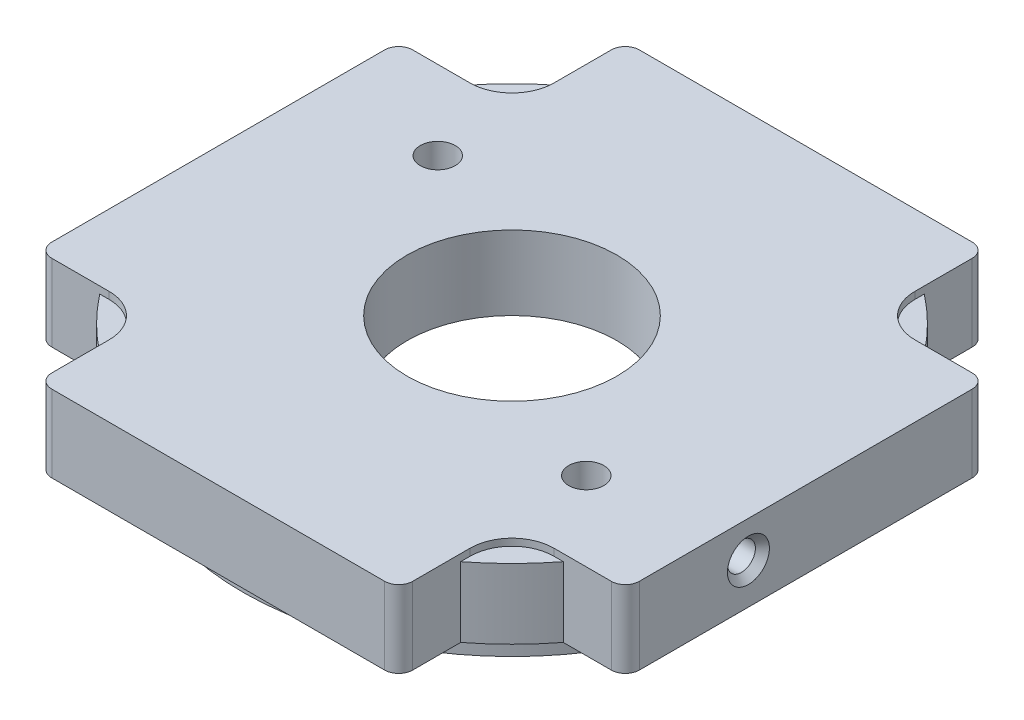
SolidWorks part; units mm, degrees
ref_plane "Front Plane" through (0, 0, 0) normal (0, 0, 1) x (1, 0, 0)
ref_plane "Top Plane" through (0, 0, 0) normal (0, 1, 0) x (1, 0, 0)
ref_plane "Right Plane" through (0, 0, 0) normal (1, 0, 0) x (0, 0, -1)
ref_plane "Plane1" through (0, 2, 0) normal (0, -1, 0) x (1, 0, 0)
sketch "Sketch1" plane through (0, 2, 0) normal (0, -1, 0) x (1, 0, 0)
  line L0 (-21, 21) -> (-21, -21)
  line L1 (-21, -21) -> (21, -21)
  line L2 (21, -21) -> (21, 21)
  line L3 (21, 21) -> (-21, 21)
extrude "Boss-Extrude1" add sketch "Sketch1" against normal blind 5.5
sketch "Sketch2" plane through (0, 2, 0) normal (0, -1, 0) x (1, 0, 0)
  line L0 (-12.9, -21) -> (-12.9, -16.5708)
  line L1 (-16.5708, -12.9) -> (-21, -12.9)
  line L2 (-21, -12.9) -> (-21, -21)
  line L3 (-21, -21) -> (-12.9, -21)
  arc A0 (-12.9, -16.5708) -> (-16.5708, -12.9) centre (0, 0) cw
extrude "Cut-Extrude1" cut sketch "Sketch2" against normal through all
ref_plane "Plane2" through (0, 7.5, 0) normal (0, 1, 0) x (-1, 0, 0)
ref_plane "Plane3" through (0, 7, 0) normal (0, -1, 0) x (1, 0, 0)
sketch "Sketch4" plane through (0, 7, 0) normal (0, -1, 0) x (1, 0, 0)
  line L0 (-12.9, -12.9) -> (-16.5708, -12.9)
  line L1 (-12.9, -16.5708) -> (-12.9, -12.9)
  arc A0 (-16.5708, -12.9) -> (-12.9, -16.5708) centre (0, 0) ccw
extrude "Cut-Extrude2" cut sketch "Sketch4" against normal up to surface
sketch "Sketch5" plane through (0, 2, 0) normal (0, -1, 0) x (1, 0, 0)
  line L0 (-21, 12.9) -> (-16.5708, 12.9)
  line L1 (-12.9, 16.5708) -> (-12.9, 21)
  line L2 (-12.9, 21) -> (-21, 21)
  line L3 (-21, 21) -> (-21, 12.9)
  arc A0 (-16.5708, 12.9) -> (-12.9, 16.5708) centre (0, 0) cw
extrude "Cut-Extrude3" cut sketch "Sketch5" against normal through all
sketch "Sketch7" plane through (0, 7, 0) normal (0, -1, 0) x (1, 0, 0)
  line L0 (-12.9, 12.9) -> (-12.9, 16.5708)
  line L1 (-16.5708, 12.9) -> (-12.9, 12.9)
  arc A0 (-12.9, 16.5708) -> (-16.5708, 12.9) centre (0, 0) ccw
extrude "Cut-Extrude4" cut sketch "Sketch7" against normal up to surface
sketch "Sketch8" plane through (0, 2, 0) normal (0, -1, 0) x (1, 0, 0)
  line L0 (12.9, 21) -> (12.9, 16.5708)
  line L1 (16.5708, 12.9) -> (21, 12.9)
  line L2 (21, 12.9) -> (21, 21)
  line L3 (21, 21) -> (12.9, 21)
  arc A0 (12.9, 16.5708) -> (16.5708, 12.9) centre (0, 0) cw
extrude "Cut-Extrude5" cut sketch "Sketch8" against normal through all
sketch "Sketch10" plane through (0, 7, 0) normal (0, -1, 0) x (1, 0, 0)
  line L0 (12.9, 12.9) -> (16.5708, 12.9)
  line L1 (12.9, 16.5708) -> (12.9, 12.9)
  arc A0 (16.5708, 12.9) -> (12.9, 16.5708) centre (0, 0) ccw
extrude "Cut-Extrude6" cut sketch "Sketch10" against normal up to surface
sketch "Sketch11" plane through (0, 2, 0) normal (0, -1, 0) x (1, 0, 0)
  line L0 (21, -12.9) -> (16.5708, -12.9)
  line L1 (12.9, -16.5708) -> (12.9, -21)
  line L2 (12.9, -21) -> (21, -21)
  line L3 (21, -21) -> (21, -12.9)
  arc A0 (16.5708, -12.9) -> (12.9, -16.5708) centre (0, 0) cw
extrude "Cut-Extrude7" cut sketch "Sketch11" against normal through all
sketch "Sketch13" plane through (0, 7, 0) normal (0, -1, 0) x (1, 0, 0)
  line L0 (12.9, -12.9) -> (12.9, -16.5708)
  line L1 (16.5708, -12.9) -> (12.9, -12.9)
  arc A0 (12.9, -16.5708) -> (16.5708, -12.9) centre (0, 0) ccw
extrude "Cut-Extrude8" cut sketch "Sketch13" against normal up to surface
sketch "Sketch14" plane through (0, 2, 0) normal (0, -1, 0) x (1, 0, 0)
  line L0 (19.0148, 3) -> (17.3932, 3)
  line L1 (17.3932, -3) -> (19.0148, -3)
  arc A0 (19.0148, -3) -> (19.0148, 3) centre (0, 0) cw
  arc A1 (17.3932, 3) -> (17.3932, -3) centre (0, 0) cw
extrude "Boss-Extrude2" add sketch "Sketch14" along normal blind 2
sketch "Sketch15" plane through (0, 0, 0) normal (0, 0, 1) x (1, 0, 0)
  line L0 (7.5, 7.5) -> (0, 7.5)
  line L1 (0, 7.5) -> (0, 0)
  line L2 (0, 0) -> (17.65, 0)
  line L3 (17.65, 0) -> (17.65, 2.2)
  line L4 (17.65, 2.2) -> (7.5, 2.2)
  line L5 (7.5, 2.2) -> (7.5, 7.5)
  line L6 (0, 7.5) -> (0, 0) construction
revolve "Cut-Revolve1" cut sketch "Sketch15" angle 360 about L6
hole_wizard "Ø2.5 (2.5) Diameter Hole1" positions "Sketch17" profile "Sketch16" hole size "Ø2.5" standard "Ansi Metric"
sketch "Sketch17" plane through (0, 7.5, 0) normal (0, 1, 0) x (-1, 0, 0)
  point P0 (12.5574, -7.25)
  point P1 (-12.5574, 7.25)
sketch "Sketch16" plane through (-12.5574, 7.5, -7.25) normal (1, 0, 0) x (0, 0, 1)
  line L0 (0, 0) -> (0, 7.5)
  line L1 (0, 7.5) -> (1.25, 7.5)
  line L2 (1.25, 7.5) -> (1.25, 0)
  line L5 (1.25, 0) -> (0, 0)
  line L11 (0, -6.35) -> (0, 107.95) construction
  dimension "Thru Hole Dia." = 2.5
  dimension "Thru Hole Depth" = 7.5
hole_wizard "Ø2.0 (2) Diameter Hole1" positions "Sketch19" profile "Sketch18" hole size "Ø2.0" standard "Ansi Metric"
sketch "Sketch19" plane through (21, 0, 0) normal (1, 0, 0) x (0, 0, -1)
  point P0 (-4.1, 4.9)
sketch "Sketch18" plane through (21, 4.9, 4.1) normal (0, 1, 0) x (0, 0, -1)
  line L0 (0, 0) -> (0, 6.75)
  line L1 (0, 6.75) -> (1, 6.75)
  line L2 (1, 6.75) -> (1, 0)
  line L5 (1, 0) -> (0, 0)
  line L10 (0, 6.75) -> (-1, 6.75) construction
  line L11 (0, -6.35) -> (0, 107.95) construction
  dimension "Hole Dia." = 2
  dimension "Hole Depth" = 6.75
  dimension "Drill Angle" = 180
chamfer "Chamfer1" distance 0.5 angle 44.999 1 edges at (21, 4.9, 3.1)
fillet "Fillet1" radius 1 8 edges at (12.9, 4.75, -21) (-12.9, 4.75, -21) (-21, 4.75, 12.9) (-21, 4.75, -12.9) (21, 4.75, -12.9) (-12.9, 4.75, 21) (12.9, 4.75, 21) (21, 4.75, 12.9)
fillet "Fillet2" radius 3 4 edges at (-12.9, 7.25, -12.9) (12.9, 7.25, -12.9) (-12.9, 7.25, 12.9) (12.9, 7.25, 12.9)
